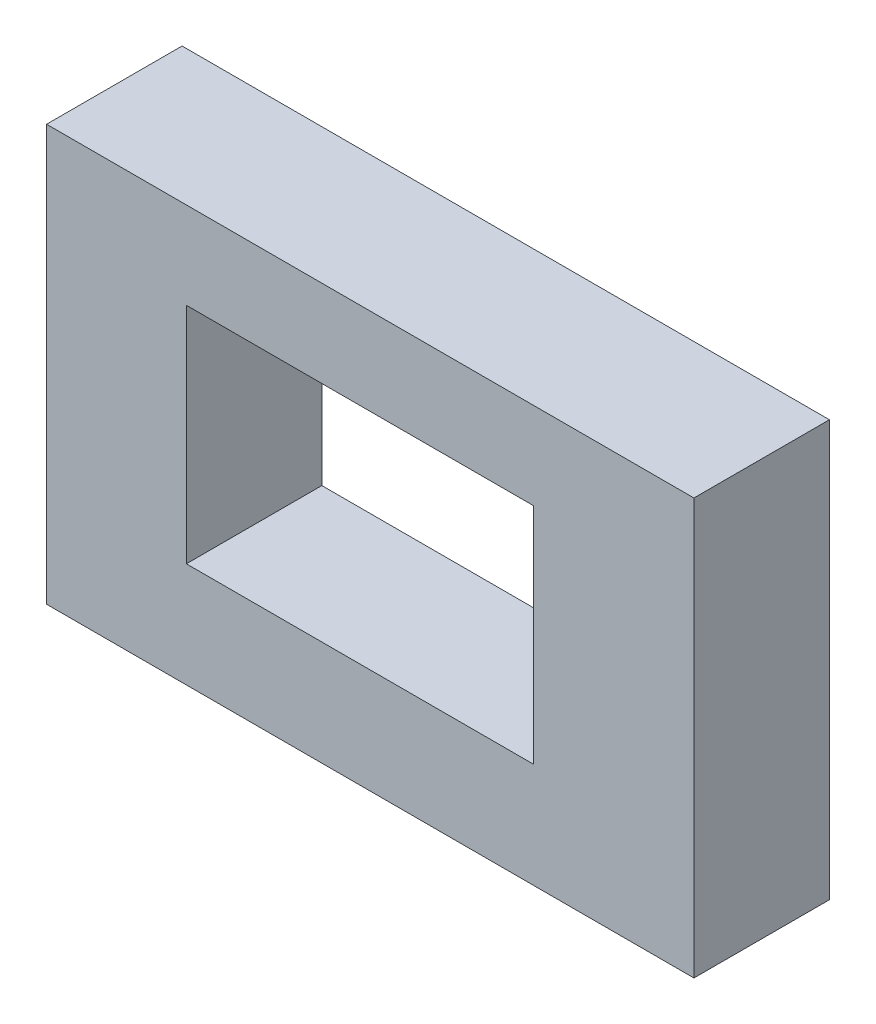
SolidWorks part; units mm, degrees
ref_plane "Front Plane" through (0, 0, 0) normal (0, 0, 1) x (1, 0, 0)
ref_plane "Top Plane" through (0, 0, 0) normal (0, 1, 0) x (1, 0, 0)
ref_plane "Right Plane" through (0, 0, 0) normal (1, 0, 0) x (0, 0, -1)
sketch "Sketch1" plane through (0, 0, 0) normal (0, 0, 1) x (1, 0, 0)
  line L1 (-23.8891, -16.2183) -> (23.8891, -16.2183)
  line L2 (-23.8891, -16.2183) -> (-23.8891, 14.465)
  line L3 (-23.8891, 14.465) -> (23.8891, 14.465)
  line L4 (23.8891, -16.2183) -> (23.8891, 14.465)
  line L5 (-23.8891, -16.2183) -> (23.8891, 14.465) construction
  line L6 (-23.8891, 14.465) -> (23.8891, -16.2183) construction
  line L7 (-13.572, -8.4737) -> (12.064, -8.4737)
  line L8 (-13.572, -8.4737) -> (-13.572, 8.0508)
  line L9 (-13.572, 8.0508) -> (12.064, 8.0508)
  line L10 (12.064, -8.4737) -> (12.064, 8.0508)
  line L11 (-13.572, -8.4737) -> (12.064, 8.0508) construction
  line L12 (-13.572, 8.0508) -> (12.064, -8.4737) construction
  point P0 (0, -0.8767)
  point P5 (-0.754, -0.2114)
extrude "Boss-Extrude1" add sketch "Sketch1" along normal blind 10
